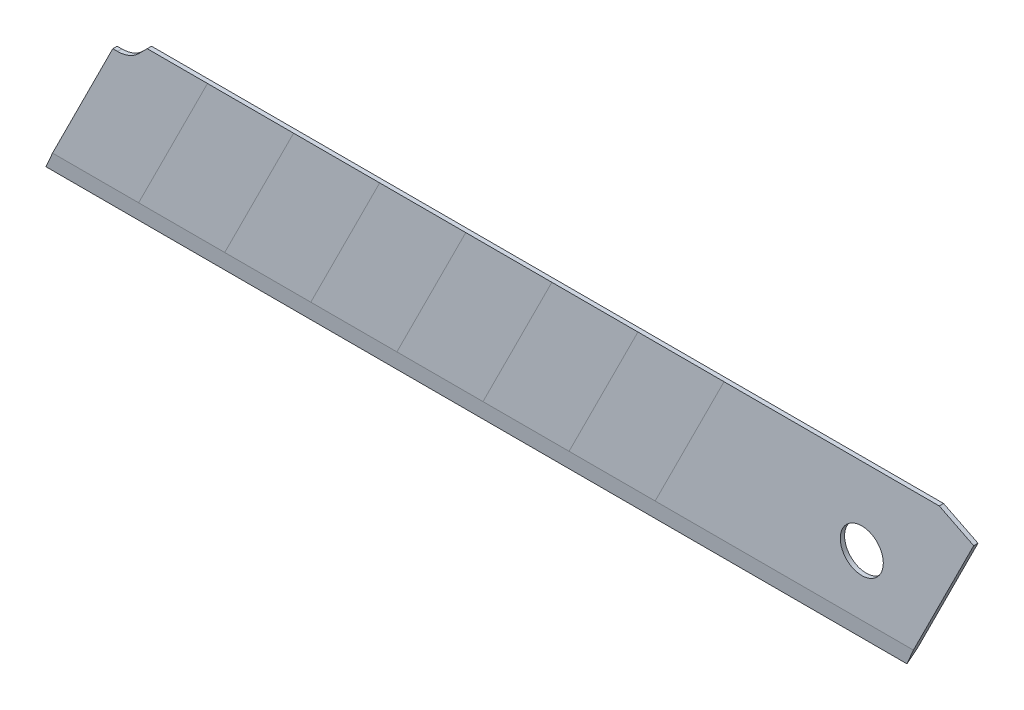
SolidWorks part; units mm, degrees
ref_plane "Plan de face" through (0, 0, 0) normal (0, 0, 1) x (1, 0, 0)
ref_plane "Plan de dessus" through (0, 0, 0) normal (0, 1, 0) x (1, 0, 0)
ref_plane "Plan de droite" through (0, 0, 0) normal (1, 0, 0) x (0, 0, -1)
sketch "Esquisse1" plane through (0, 0, 0) normal (0, 0, 1) x (1, 0, 0)
  line L0 (0, 0) -> (9, 18)
  line L1 (9, 18) -> (109, 18)
  line L2 (109, 18) -> (100, 0)
  line L3 (100, 0) -> (0, 0)
  circle A0 centre (95, 9) radius 2.5
  dimension "D4" = 5
  dimension "D1" = 100
  dimension "D2" = 18
  dimension "D3" = 9
  dimension "D5" = 5
  dimension "D6" = 9
extrude "Boss.-Extru.1" add sketch "Esquisse1" along normal blind 0.5
sketch "Esquisse2" plane through (0, 0, 0.5) normal (0, 0, 1) x (1, 0, 0)
  line L0 (104, 18) -> (108, 16)
  line L1 (109, 18) -> (9, 18) construction
  line L2 (100, 0) -> (109, 18) construction
  line L3 (108, 16) -> (109, 18)
  line L4 (109, 18) -> (104, 18)
  line L5 (8, 16) -> (8.5503, 16)
  line L6 (9, 18) -> (0, 0) construction
  line L7 (11.0251, 17.0251) -> (12, 18)
  line L8 (8, 16) -> (9, 18)
  line L9 (9, 18) -> (12, 18)
  arc A0 (8.5503, 16) -> (11.0251, 17.0251) centre (8.5503, 19.5) ccw
  point P17 (10, 16)
  dimension "D6" = 3.5
  dimension "D1" = 2
  dimension "D2" = 4
  dimension "D3" = 2
  dimension "D4" = 4
  dimension "D5" = 2
extrude "Enlèv. mat.-Extru.1" cut sketch "Esquisse2" against normal through all
chamfer "Chanfrein2" distance 0.24 distance2 2 2 edges at (50, 0, 0) (50, 0, 0.5)
sketch "Esquisse3" plane through (0, 0, 0.5) normal (0, 0, 1) x (1, 0, 0)
  line L0 (19, 18) -> (10, 0)
  line L1 (104, 18) -> (12, 18) construction
  line L2 (0, 0) -> (100, 0) construction
  line L3 (8, 16) -> (1, 2) construction
  line L4 (29, 18) -> (20, 0)
  line L5 (39, 18) -> (30, 0)
  line L6 (49, 18) -> (40, 0)
  line L7 (59, 18) -> (50, 0)
  line L8 (69, 18) -> (60, 0)
  line L9 (79, 18) -> (70, 0)
  line L10 (19, 18) -> (29, 18) construction
  dimension "D1" = 10
  dimension "D3" = 10
  dimension "D2" = 7
